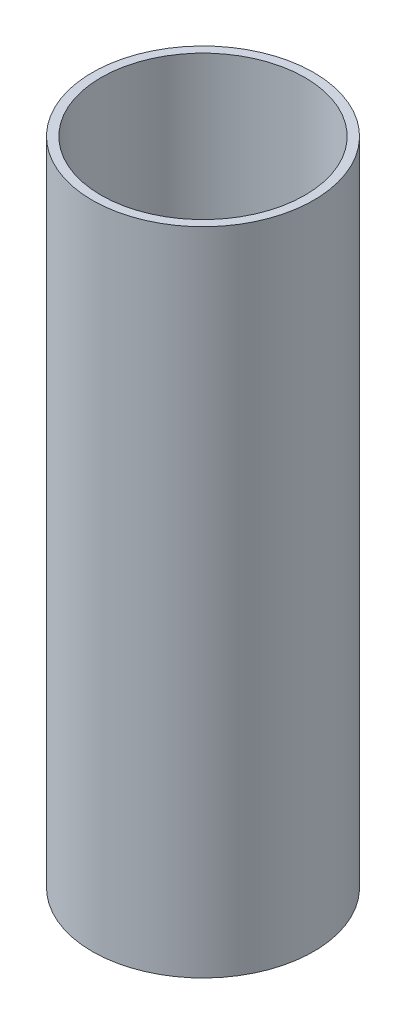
SolidWorks part; units mm, degrees
ref_plane "Front Plane" through (0, 0, 0) normal (0, 0, 1) x (1, 0, 0)
ref_plane "Top Plane" through (0, 0, 0) normal (0, 1, 0) x (1, 0, 0)
ref_plane "Right Plane" through (0, 0, 0) normal (1, 0, 0) x (0, 0, -1)
sketch "Sketch1" plane through (0, 0, 0) normal (0, 1, 0) x (1, 0, 0)
  circle A0 centre (0, 0) radius 34.8615
  circle A1 centre (0, 0) radius 37.846
  dimension "D1" = 75.692
  dimension "D2" = 2.9845
extrude "Boss-Extrude1" add sketch "Sketch1" along normal blind 222.4354
